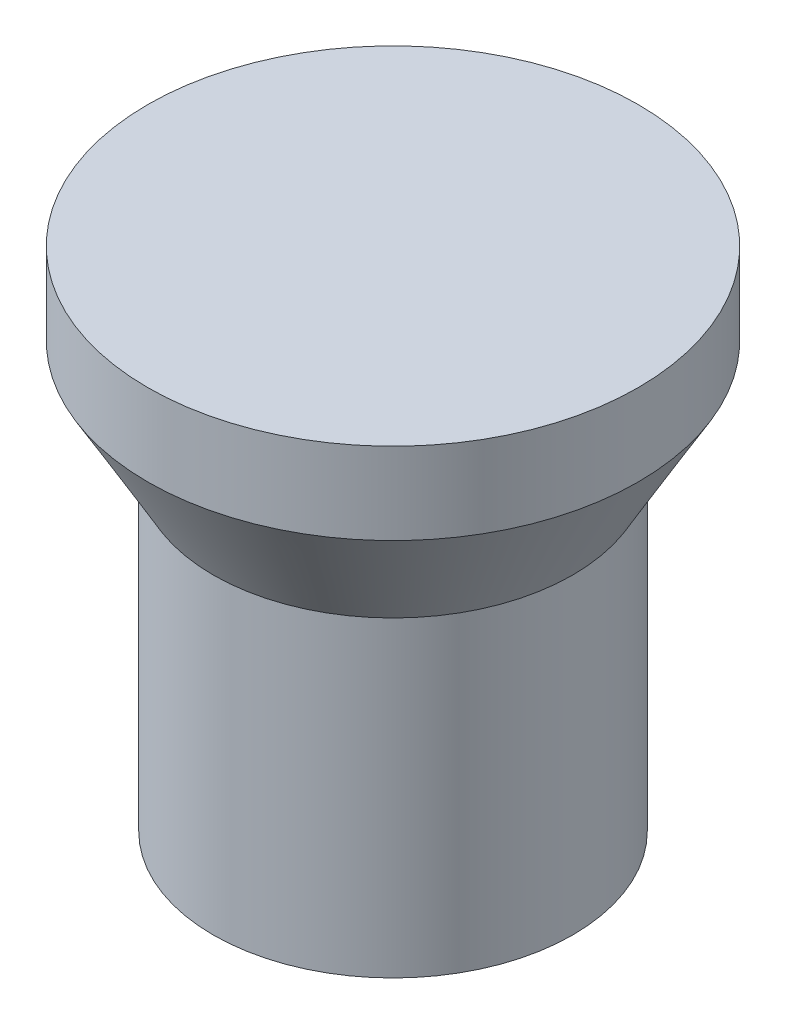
SolidWorks part; units mm, degrees
ref_plane "Front Plane" through (0, 0, 0) normal (0, 0, 1) x (1, 0, 0)
ref_plane "Top Plane" through (0, 0, 0) normal (0, 1, 0) x (1, 0, 0)
ref_plane "Right Plane" through (0, 0, 0) normal (1, 0, 0) x (0, 0, -1)
sketch "Sketch1" plane through (0, 0, 0) normal (0, 0, 1) x (1, 0, 0)
  line L0 (0, 36.1554) -> (0, 1) construction
  line L1 (0, 31) -> (0, 1)
  line L2 (7.477, 1) -> (-7.477, 1) construction
  line L3 (9, -0.3569) -> (9, 0.3569) construction
  line L4 (9, 0) -> (11, 0)
  line L5 (11, 0) -> (11, 19.0718)
  line L9 (11, 19.0718) -> (15, 26)
  line L10 (15, 26) -> (15, 31)
  line L11 (15, 31) -> (0, 31)
  line L12 (0, 31) -> (0.0577, 31.0344)
  spline S0 degree 3 poles (0, 1) (6.286, 1) (6.6366, 0.9544) (9.0762, 0.3822) (9, 0.2524) (9, 0) knots 0 0 0 0 0.49592 0.59592 1 1 1 1
  dimension "D7" = 1
  dimension "D8" = 2
  dimension "D1" = 30
  dimension "D2" = 5
  dimension "D3" = 15
  dimension "D4" = 30
  dimension "D5" = 1
  dimension "D6" = 9
revolve "Revolve1" add sketch "Sketch1" angle 360 about L0
